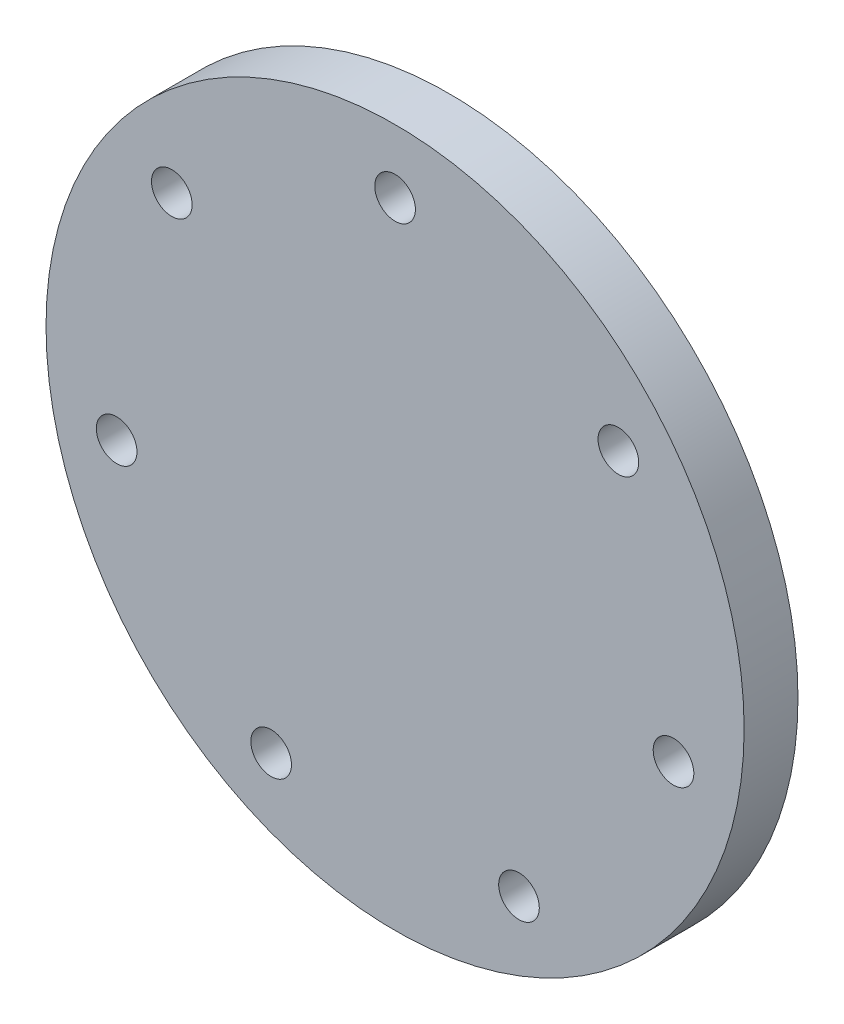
SolidWorks part; units mm, degrees
ref_plane "Ebene vorne" through (0, 0, 0) normal (0, 0, 1) x (1, 0, 0)
ref_plane "Ebene oben" through (0, 0, 0) normal (0, 1, 0) x (1, 0, 0)
ref_plane "Ebene rechts" through (0, 0, 0) normal (1, 0, 0) x (0, 0, -1)
sketch "Skizze1" plane through (0, 0, 0) normal (0, 0, 1) x (1, 0, 0)
  circle A0 centre (0, 0) radius 64.8294
extrude "Aufsatz-Linear austragen1" add sketch "Skizze1" along normal blind 10
sketch "Skizze2" plane through (0, 0, 10) normal (0, 0, 1) x (1, 0, 0)
  circle A0 centre (0, 53.0384) radius 3.773
extrude "Schnitt-Linear austragen1" cut sketch "Skizze2" against normal blind 10
pattern_circular "Kreismuster1" count 7 over 360 about axis through (0, 0, 0) along (0, 0, 1) of "Schnitt-Linear austragen1"
